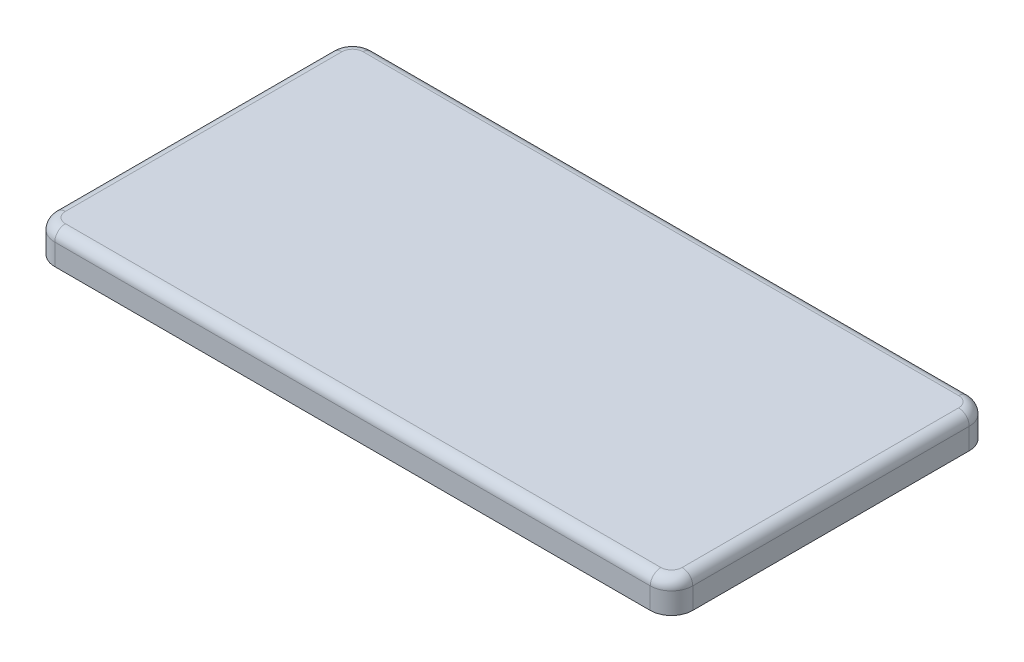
SolidWorks part; units mm, degrees
ref_plane "正面" through (0, 0, 0) normal (0, 0, 1) x (1, 0, 0)
ref_plane "平面" through (0, 0, 0) normal (0, 1, 0) x (1, 0, 0)
ref_plane "右側面" through (0, 0, 0) normal (1, 0, 0) x (0, 0, -1)
sketch "ｽｹｯﾁ1" plane through (0, 0, 0) normal (0, 1, 0) x (0, 0, -1)
  line L1 (-13, 30) -> (13, 30)
  line L2 (-15, 28) -> (-15, -28)
  line L3 (-13, -30) -> (13, -30)
  line L4 (15, 28) -> (15, -28)
  arc A0 (15, 28) -> (13, 30) centre (13, 28) ccw
  arc A1 (13, -30) -> (15, -28) centre (13, -28) ccw
  arc A2 (-15, -28) -> (-13, -30) centre (-13, -28) ccw
  arc A3 (-13, 30) -> (-15, 28) centre (-13, 28) ccw
  point P7 (15, 30)
  point P10 (15, -30)
  point P15 (-15, 30)
  dimension "D5" = 2
  dimension "D1" = 15
  dimension "D2" = 30
  dimension "D3" = 30
  dimension "D4" = 60
extrude "押し出し1" add sketch "ｽｹｯﾁ1" along normal mid plane 3
fillet "ﾌｨﾚｯﾄ1" radius 1 8 edges at (-29.4142, 1.5, 14.4142) (-30, 1.5, 0) (-29.4142, 1.5, -14.4142) (0, 1.5, -15) (29.4142, 1.5, -14.4142) (30, 1.5, 0) (29.4142, 1.5, 14.4142) (0, 1.5, 15)
sketch "ｽｹｯﾁ2" plane through (0, -1.5, 0) normal (0, -1, 0) x (1, 0, 0)
  line L1 (-28, 13.2) -> (28, 13.2)
  line L2 (-28.2, 13) -> (-28.2, -13)
  line L3 (-28, -13.2) -> (28, -13.2)
  line L4 (28.2, 13) -> (28.2, -13)
  arc A0 (-28, 13.2) -> (-28.2, 13) centre (-28, 13) ccw
  arc A1 (28.2, 13) -> (28, 13.2) centre (28, 13) ccw
  arc A2 (28, -13.2) -> (28.2, -13) centre (28, -13) ccw
  arc A3 (-28.2, -13) -> (-28, -13.2) centre (-28, -13) ccw
  point P7 (-28.2, 13.2)
  point P10 (28.2, 13.2)
  point P13 (28.2, -13.2)
  dimension "D5" = 0.2
  dimension "D1" = 28.2
  dimension "D2" = 56.4
  dimension "D3" = 13.2
  dimension "D4" = 26.4
extrude "押し出し2" cut sketch "ｽｹｯﾁ2" against normal blind 1
sketch "ｽｹｯﾁ4" plane through (0, -0.5, 0) normal (0, -1, 0) x (1, 0, 0)
  line L0 (-30, -13) -> (-30, 13) construction
  line L1 (-16.65, 2.45) -> (-13.35, 2.45)
  line L2 (-16.65, 2.45) -> (-16.65, -2.45)
  line L3 (-16.65, -2.45) -> (-13.35, -2.45)
  line L4 (-13.35, 2.45) -> (-13.35, -2.45)
  line L5 (30, 13) -> (30, -13) construction
  line L6 (13.35, -2.45) -> (16.65, -2.45)
  line L7 (13.35, -2.45) -> (13.35, 2.45)
  line L8 (13.35, 2.45) -> (16.65, 2.45)
  line L9 (16.65, -2.45) -> (16.65, 2.45)
  dimension "D1" = 3.3
  dimension "D2" = 4.9
  dimension "D3" = 13.35
  dimension "D4" = 2.45
  dimension "D5" = 3.3
  dimension "D6" = 2.45
  dimension "D7" = 4.9
  dimension "D8" = 13.35
extrude "押し出し4" add sketch "ｽｹｯﾁ4" along normal blind 8 draft 0.6
fillet "ﾌｨﾚｯﾄ2" radius 0.8 8 edges at (-15, -8.5, 2.3662) (-13.4338, -8.5, 0) (-15, -8.5, -2.3662) (-16.5662, -8.5, 0) (15, -8.5, 2.3662) (16.5662, -8.5, 0) (15, -8.5, -2.3662) (13.4338, -8.5, 0)
